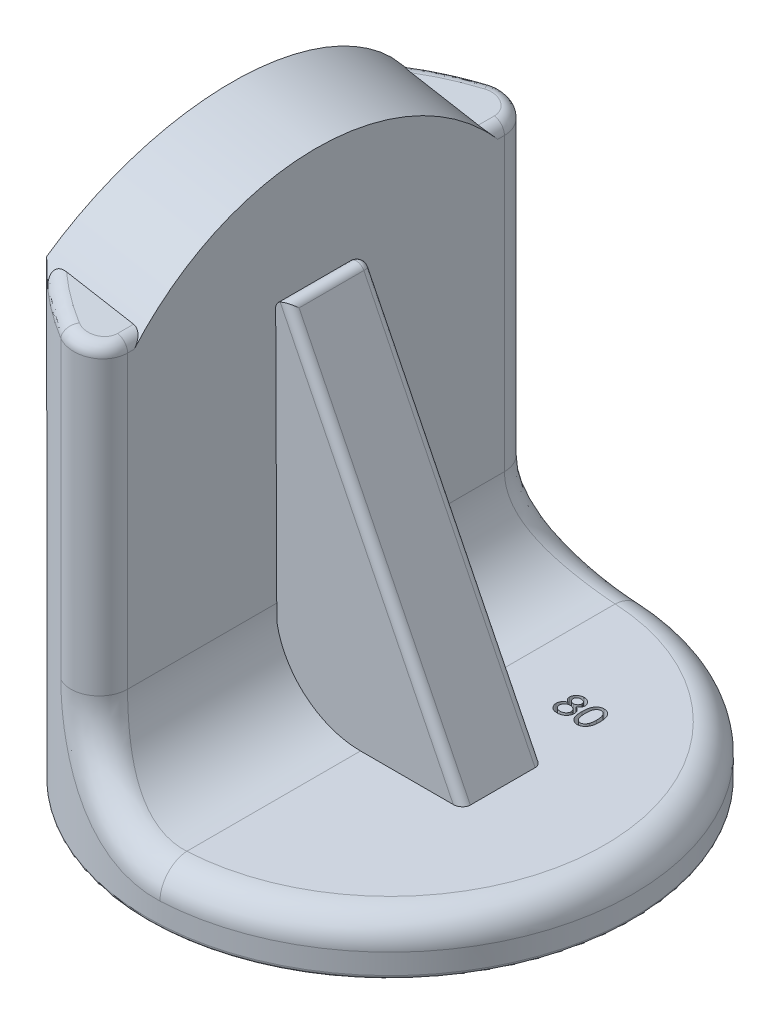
SolidWorks part; units mm, degrees
ref_plane "Front Plane" through (0, 0, 0) normal (0, 0, 1) x (1, 0, 0)
ref_plane "Top Plane" through (0, 0, 0) normal (0, 1, 0) x (1, 0, 0)
ref_plane "Right Plane" through (0, 0, 0) normal (1, 0, 0) x (0, 0, -1)
sketch "Sketch1" plane through (0, 0, 0) normal (0, 1, 0) x (1, 0, 0)
  circle A0 centre (0, 0) radius 30
extrude "Boss-Extrude1" add sketch "Sketch1" along normal blind 80
sketch "Sketch3" plane through (0, 80, 0) normal (0, 1, 0) x (1, 0, 0)
sketch "Sketch4" plane through (0, 0, 0) normal (0, -1, 0) x (-1, 0, 0)
  line L0 (0, 0) -> (-10, 0) construction
  line L1 (0, 0) -> (0, -10) construction
  line L2 (0, 0) -> (0, 10) construction
  line L3 (0, 0) -> (10, 0) construction
  line L5 (-2.5, 2.5) -> (2.5, 2.5)
  line L6 (-2.5, 2.5) -> (-2.5, -2.5)
  line L7 (-2.5, -2.5) -> (2.5, -2.5)
  line L8 (2.5, 2.5) -> (2.5, -2.5)
  line L9 (-2.5, 2.5) -> (2.5, -2.5) construction
  line L10 (-2.5, -2.5) -> (2.5, 2.5) construction
  line L11 (-2.5, -7.5) -> (2.5, -7.5)
  line L12 (-2.5, -7.5) -> (-2.5, -12.5)
  line L13 (-2.5, -12.5) -> (2.5, -12.5)
  line L14 (2.5, -7.5) -> (2.5, -12.5)
  line L15 (-2.5, -7.5) -> (2.5, -12.5) construction
  line L16 (-2.5, -12.5) -> (2.5, -7.5) construction
  line L17 (7.5, 2.5) -> (12.5, 2.5)
  line L18 (7.5, 2.5) -> (7.5, -2.5)
  line L19 (7.5, -2.5) -> (12.5, -2.5)
  line L20 (12.5, 2.5) -> (12.5, -2.5)
  line L21 (7.5, 2.5) -> (12.5, -2.5) construction
  line L22 (7.5, -2.5) -> (12.5, 2.5) construction
  line L23 (-12.5, 2.5) -> (-7.5, 2.5)
  line L24 (-12.5, 2.5) -> (-12.5, -2.5)
  line L25 (-12.5, -2.5) -> (-7.5, -2.5)
  line L26 (-7.5, 2.5) -> (-7.5, -2.5)
  line L27 (-12.5, 2.5) -> (-7.5, -2.5) construction
  line L28 (-12.5, -2.5) -> (-7.5, 2.5) construction
  line L29 (2.5, 7.5) -> (-2.5, 7.5)
  line L30 (2.5, 7.5) -> (2.5, 12.5)
  line L31 (2.5, 12.5) -> (-2.5, 12.5)
  line L32 (-2.5, 7.5) -> (-2.5, 12.5)
  line L33 (2.5, 7.5) -> (-2.5, 12.5) construction
  line L34 (2.5, 12.5) -> (-2.5, 7.5) construction
  dimension "D1" = 5
  dimension "D2" = 5
  dimension "D3" = 5
  dimension "D4" = 5
  dimension "D5" = 5
  dimension "D6" = 5
extrude "Cut-Extrude2" cut sketch "Sketch4" against normal blind 3
fillet "Fillet2" radius 0.5 21 edges at (0, 0, 30) (2.5, 0, 0) (0, 0, 2.5) (-2.5, 0, 0) (0, 0, -2.5) (2.5, 0, 10) (0, 0, 12.5) (-2.5, 0, 10) (0, 0, 7.5) (-7.5, 0, 0) (-10, 0, 2.5) (-12.5, 0, 0) (-10, 0, -2.5) (12.5, 0, 0) (10, 0, 2.5) (7.5, 0, 0) (10, 0, -2.5) (-2.5, 0, -10) (0, 0, -12.5) (2.5, 0, -10) (0, 0, -7.5)
ref_plane "Plane6" through (0, 0, 3.5) normal (0, 0, 1) x (1, 0, 0)
sketch "Sketch13" plane through (0, 0, 3.5) normal (0, 0, 1) x (1, 0, 0)
  line L0 (-30, 6) -> (-16.9518, 80)
  line L1 (-30, 80) -> (-30, 0.5) construction
  line L4 (-16.9518, 80) -> (-30, 80)
  line L5 (-30, 80) -> (-30, 6)
  line L6 (30, 0.5) -> (-30, 0.5) construction
  dimension "D1" = 5.5
  dimension "D2" = 80
extrude "Cut-Extrude10" cut sketch "Sketch13" against normal mid plane 90
ref_plane "Plane4" through (0, 0, -2.5) normal (0, 0, -1) x (-1, 0, 0)
ref_plane "Plane5" through (0, 0, -62.5) normal (0, 0, -1) x (-1, 0, 0)
sketch "Sketch15" plane through (-30.1214, 5.3112, 0) normal (-0.9848, 0.1736, 0) x (0.1736, 0.9848, 0)
  line L0 (0.6994, 0) -> (0, 0) construction
  line L2 (23.1994, -2.5) -> (18.1994, -2.5)
  line L3 (23.1994, -2.5) -> (23.1994, 2.5)
  line L4 (23.1994, 2.5) -> (18.1994, 2.5)
  line L5 (18.1994, -2.5) -> (18.1994, 2.5)
  line L6 (23.1994, -2.5) -> (18.1994, 2.5) construction
  line L7 (23.1994, 2.5) -> (18.1994, -2.5) construction
  line L8 (33.1994, -2.5) -> (28.1994, -2.5)
  line L9 (33.1994, -2.5) -> (33.1994, 2.5)
  line L10 (33.1994, 2.5) -> (28.1994, 2.5)
  line L11 (28.1994, -2.5) -> (28.1994, 2.5)
  line L12 (33.1994, -2.5) -> (28.1994, 2.5) construction
  line L13 (33.1994, 2.5) -> (28.1994, -2.5) construction
  line L14 (43.1994, -2.5) -> (38.1994, -2.5)
  line L15 (43.1994, -2.5) -> (43.1994, 2.5)
  line L16 (43.1994, 2.5) -> (38.1994, 2.5)
  line L17 (38.1994, -2.5) -> (38.1994, 2.5)
  line L18 (43.1994, -2.5) -> (38.1994, 2.5) construction
  line L19 (43.1994, 2.5) -> (38.1994, -2.5) construction
  line L20 (33.1994, -12.5) -> (28.1994, -12.5)
  line L21 (33.1994, -12.5) -> (33.1994, -7.5)
  line L22 (33.1994, -7.5) -> (28.1994, -7.5)
  line L23 (28.1994, -12.5) -> (28.1994, -7.5)
  line L24 (33.1994, -12.5) -> (28.1994, -7.5) construction
  line L25 (33.1994, -7.5) -> (28.1994, -12.5) construction
  line L26 (33.1994, 7.5) -> (28.1994, 7.5)
  line L27 (33.1994, 7.5) -> (33.1994, 12.5)
  line L28 (33.1994, 12.5) -> (28.1994, 12.5)
  line L29 (28.1994, 7.5) -> (28.1994, 12.5)
  line L30 (33.1994, 7.5) -> (28.1994, 12.5) construction
  line L31 (33.1994, 12.5) -> (28.1994, 7.5) construction
  ellipse E0 centre (173.4625, 0) end of major axis (0.6994, 0) minor radius 30 construction
  point P9 (20.6994, 0)
  point P14 (30.6994, 0)
  point P19 (40.6994, 0)
  point P24 (30.6994, -10)
  point P29 (30.6994, 10)
  dimension "D1" = 40
  dimension "D2" = 30
  dimension "D3" = 20
  dimension "D4" = 5
  dimension "D5" = 5
  dimension "D6" = 5
  dimension "D7" = 5
  dimension "D8" = 5
  dimension "D9" = 5
  dimension "D10" = 5
  dimension "D11" = 5
  dimension "D12" = 10
  dimension "D13" = 10
  dimension "D14" = 5
  dimension "D15" = 5
extrude "Cut-Extrude11" cut sketch "Sketch15" against normal blind 3
ref_plane "Plane7" through (0, 0, 0) normal (0, 0, -1) x (-1, 0, 0)
sketch "Sketch24" plane through (-30.1214, 5.3112, 0) normal (-0.9848, 0.1736, 0) x (0.1736, 0.9848, 0)
  line L0 (30.6994, -30) -> (8.2869, -61.3494)
  line L1 (30.6994, 0) -> (0.6994, 0)
  line L3 (8.2869, -61.3494) -> (91.449, -58.1784)
  line L4 (91.449, -58.1784) -> (76.5573, 58.2179)
  line L5 (76.5573, 58.2179) -> (30.6994, 46.8115)
  line L6 (30.6994, 46.8115) -> (30.6994, 30)
  arc A0 (30.6994, -30) -> (0.6994, 0) centre (30.6994, 0) ccw
  ellipse E1 centre (173.4625, 0) end of major axis (0.6994, 0) minor radius 30 construction
  dimension "D1" = 30
extrude "Cut-Extrude13" cut sketch "Sketch24" against normal blind 100 contours A0 M21
fillet "Fillet8" radius 0.5 4 edges at (-24.7906, 35.5442, -7.5) (-24.3564, 38.0063, -10) (-24.7906, 35.5442, -12.5) (-25.2247, 33.0822, -10)
fillet "Fillet9" radius 0.5 4 edges at (-23.0541, 45.3923, 2.5) (-22.62, 47.8543, 0) (-23.0541, 45.3923, -2.5) (-23.4882, 42.9303, 0)
fillet "Fillet10" radius 0.5 4 edges at (-26.9612, 23.2341, 0) (-26.527, 25.6962, 2.5) (-26.0929, 28.1582, 0) (-26.527, 25.6962, -2.5)
fillet "Fillet11" radius 0.5 4 edges at (-25.2247, 33.0822, 10) (-24.7906, 35.5442, 12.5) (-24.3564, 38.0063, 10) (-24.7906, 35.5442, 7.5)
fillet "Fillet12" radius 0.5 4 edges at (-25.2247, 33.0822, 0) (-24.7906, 35.5442, 2.5) (-24.3564, 38.0063, 0) (-24.7906, 35.5442, -2.5)
sketch "Sketch26" plane through (0, 0, 3.5) normal (0, 0, 1) x (1, 0, 0)
  line L1 (21.1305, 54.6487) -> (36.0272, 54.6487)
  line L2 (21.1305, 54.6487) -> (21.1305, 40.5617)
  line L3 (21.1305, 40.5617) -> (36.0272, 40.5617)
  line L4 (36.0272, 54.6487) -> (36.0272, 40.5617)
  line L5 (21.1305, 54.6487) -> (36.0272, 40.5617) construction
  line L6 (21.1305, 40.5617) -> (36.0272, 54.6487) construction
  point P0 (28.5788, 47.6052)
sketch "Sketch27" plane through (-30.1214, 5.3112, 0) normal (-0.9848, 0.1736, 0) x (0, 0, 1)
  line L0 (21.3034, 51.822) -> (33.933, 51.822)
  line L1 (33.933, 51.822) -> (33.933, 52.9731)
  line L2 (33.933, 52.9731) -> (21.3034, 52.9731)
  line L3 (21.3034, 52.9731) -> (21.3034, 51.822)
  line L4 (-21.3034, 51.822) -> (-35.0532, 51.822)
  line L5 (-35.0532, 51.822) -> (-35.0532, 54.6027)
  line L6 (-35.0532, 54.6027) -> (-21.3034, 54.6027)
  line L7 (-21.3034, 54.6027) -> (-21.3034, 51.822)
extrude "Cut-Extrude14" cut sketch "Sketch27" against normal blind 30
sketch "Sketch29" plane through (0, 0, 3.5) normal (0, 0, 1) x (1, 0, 0)
  line L1 (9.0804, 82.4773) -> (38.2479, 82.4773)
  line L2 (9.0804, 82.4773) -> (9.0804, 63.7029)
  line L3 (9.0804, 63.7029) -> (38.2479, 63.7029)
  line L4 (38.2479, 82.4773) -> (38.2479, 63.7029)
extrude "Cut-Extrude15" cut sketch "Sketch29" against normal mid plane 100
sketch "Sketch30" plane through (0, 0, 3.5) normal (0, 0, 1) x (1, 0, 0)
  line L0 (-9.1507, 6.5) -> (30, 6.5)
  line L1 (30, 0.5) -> (30, 56.346) construction
  line L2 (30, 6.5) -> (30, 56.346)
  line L3 (30, 56.346) -> (-9.1507, 63.2493)
  line L4 (30, 56.346) -> (-19.5811, 65.0885) construction
  line L5 (-9.1507, 63.2493) -> (-9.1507, 6.5)
  line L6 (30, 0.5) -> (-30, 0.5) construction
  dimension "D1" = 6
extrude "Cut-Extrude16" cut sketch "Sketch30" against normal mid plane 100
fillet "Fillet13" radius 10.5 1 edges at (-9.1507, 6.5, 0)
fillet "Fillet14" radius 3.5 5 edges at (-9.1507, 35.6175, -28.5703) (-6.9827, 10.6103, -29.1761) (-4.9681, 8.613, 29.5858) (-9.1507, 35.6175, 28.5703) (30, 6.5, 0)
fillet "Fillet15" radius 1.5 6 edges at (-10.8616, 54.5367, -26.2936) (-10.8616, 54.5367, 26.2936) (-9.1507, 54.235, -22.2944) (-9.1507, 54.235, 22.2944)
sketch "Sketch31" plane through (-30.1214, 5.3112, 0) normal (-0.9848, 0.1736, 0) x (0, 0, 1)
  line L0 (2.8711, 67.7514) -> (38.4659, 42.3207)
  line L1 (38.4659, 42.3207) -> (41.9292, 89.496)
  line L2 (41.9292, 89.496) -> (-40.7219, 85.6618)
  line L3 (-40.7219, 85.6618) -> (-36.081, 45.813)
  line L4 (-36.081, 45.813) -> (2.8711, 67.7514)
extrude "Cut-Extrude17" cut sketch "Sketch31" against normal blind 100
sketch "Sketch32" plane through (-30.1214, 5.3112, 0) normal (-0.9848, 0.1736, 0) x (0, 0, 1)
  line L0 (21.5668, 52.408) -> (25.1159, 52.408)
  line L1 (25.1159, 52.408) -> (25.1159, 56.0399)
  line L2 (25.1159, 56.0399) -> (19.4748, 55.0695)
  line L3 (19.4748, 55.0695) -> (21.5668, 52.408)
extrude "Cut-Extrude18" cut sketch "Sketch32" against normal blind 100
sketch "Sketch33" plane through (0, 0, 0) normal (0, 0, -1) x (-1, 0, 0)
  line L0 (9.1507, 52.9764) -> (-13.9246, 6.5)
  line L1 (-1.3493, 6.5) -> (-26.5, 6.5) construction
  line L2 (-13.9246, 6.5) -> (8.9557, 6.5)
  line L3 (8.9557, 6.5) -> (9.1507, 52.9764)
  spline S0 degree 3 poles (-1.5275, 3) (-0.5272, 3) (0.4602, 3.0829) (1.9224, 3.3287) (2.4067, 3.431) (3.3687, 3.6775) (3.8457, 3.8217) (5.2393, 4.3094) (6.1283, 4.7094) (7.4026, 5.4253) (7.8187, 5.6845) (8.6167, 6.2341) (9.0001, 6.5252) (9.7363, 7.1408) (10.0891, 7.4653) (10.7636, 8.1496) (11.0867, 8.5113) (11.9957, 9.6408) (12.5174, 10.4447) (13.1686, 11.7368) (13.3636, 12.182) (13.6201, 12.8741) (13.6998, 13.1095) (13.8444, 13.5817) (13.9096, 13.8193) (14.2004, 15.0146) (14.3215, 15.9943) (14.3215, 17) knots 0 0 0 0 0.125 0.125 0.1875 0.1875 0.25 0.25 0.375 0.375 0.4375 0.4375 0.5 0.5 0.5625 0.5625 0.625 0.625 0.75 0.75 0.8125 0.8125 0.84375 0.84375 0.875 0.875 1 1 1 1 construction
extrude "Boss-Extrude3" add sketch "Sketch33" along normal mid plane 10 separate body
fillet "Fillet17" radius 1 1 edges at (-9.0532, 29.7382, -5)
sketch "Sketch36" plane through (0, 6.5, 0) normal (0, 1, 0) x (1, 0, 0)
  text T0 "<b>80</b>" font "Century Gothic" height 3.175
extrude "Cut-Extrude19" cut sketch "Sketch36" against normal blind 2
fillet "Fillet18" radius 1 4 edges at (-9.1507, 52.9764, 0.5) (-8.8553, 52.3814, -4.7071) (2.8912, 28.7225, -5) (2.387, 29.7382, 5)
